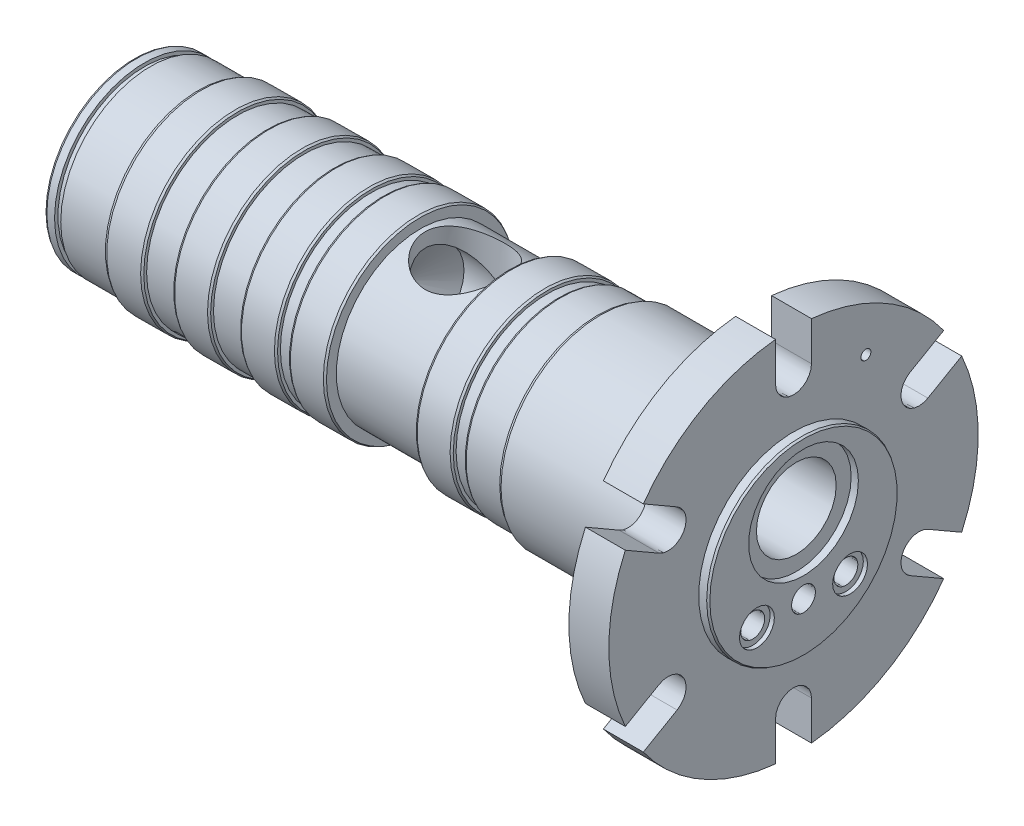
SolidWorks part; units mm, degrees
ref_plane "Face" through (0, 0, 0) normal (0, 0, 1) x (1, 0, 0)
ref_plane "Cote" through (0, 0, 0) normal (0, 1, 0) x (1, 0, 0)
ref_plane "Dessus" through (0, 0, 0) normal (1, 0, 0) x (0, 0, -1)
sketch "Esquisse1" plane through (0, 0, 0) normal (0, 0, 1) x (1, 0, 0)
  line L0 (0, 0) -> (-383.6116, 0) construction
  line L1 (-377.5177, 0) -> (-377.5177, 44.3726)
  line L2 (-376.5177, 44.95) -> (-372.6677, 44.95)
  line L3 (-372.6677, 44.95) -> (-372.6677, 43.25)
  line L4 (-372.6677, 43.25) -> (-369.5177, 43.25)
  line L5 (-369.5177, 43.25) -> (-369.5177, 45)
  line L6 (-369.5177, 45) -> (-345.5177, 45)
  line L7 (-345.5177, 45) -> (-345.5177, 46.634)
  line L8 (-344.0177, 47.5) -> (-327.0177, 47.5)
  line L9 (-145.5177, 47.5) -> (-145.5177, 49.134)
  line L10 (-144.0177, 50) -> (-67.5177, 50)
  line L11 (-67.5177, 50) -> (-67.5177, 92.5)
  line L12 (-67.5177, 92.5) -> (-47.5177, 92.5)
  line L13 (-47.5177, 92.5) -> (-47.5177, 47.5)
  line L14 (-47.5177, 47.5) -> (-43.5177, 47.5)
  line L15 (-42.5177, 46.9226) -> (-42.5177, 0)
  line L16 (-376.5177, 44.95) -> (-377.5177, 44.3726)
  line L17 (-345.5177, 46.634) -> (-344.0177, 47.5)
  line L18 (-326.0177, 46.9226) -> (-326.0177, 45.5)
  line L19 (-326.0177, 45.5) -> (-311.0177, 45.5)
  line L20 (-311.0177, 45.5) -> (-311.0177, 46.9226)
  line L21 (-292.5177, 46.9226) -> (-292.5177, 45.5)
  line L22 (-292.5177, 45.5) -> (-277.5177, 45.5)
  line L23 (-277.5177, 45.5) -> (-277.5177, 46.9226)
  line L24 (-259.0177, 46.9226) -> (-259.0177, 45.5)
  line L25 (-259.0177, 45.5) -> (-253.0177, 45.5)
  line L26 (-253.0177, 45.5) -> (-253.0177, 46.9226)
  line L27 (-234.5177, 46.9226) -> (-234.5177, 42)
  line L28 (-234.5177, 42) -> (-189.5177, 42)
  line L29 (-189.5177, 42) -> (-189.5177, 46.9226)
  line L30 (-171.0177, 46.9226) -> (-171.0177, 45.5)
  line L31 (-171.0177, 45.5) -> (-165.0177, 45.5)
  line L32 (-165.0177, 45.5) -> (-165.0177, 46.9226)
  line L33 (-164.0177, 47.5) -> (-145.5177, 47.5)
  line L34 (-188.5177, 47.5) -> (-172.0177, 47.5)
  line L35 (-252.0177, 47.5) -> (-235.5177, 47.5)
  line L36 (-276.5177, 47.5) -> (-260.0177, 47.5)
  line L37 (-310.0177, 47.5) -> (-293.5177, 47.5)
  line L38 (-145.5177, 49.134) -> (-144.0177, 50)
  line L39 (-43.5177, 47.5) -> (-42.5177, 46.9226)
  line L40 (-327.0177, 47.5) -> (-326.0177, 46.9226)
  line L41 (-311.0177, 46.9226) -> (-310.0177, 47.5)
  line L42 (-292.5177, 46.9226) -> (-293.5177, 47.5)
  line L43 (-277.5177, 46.9226) -> (-276.5177, 47.5)
  line L44 (-260.0177, 47.5) -> (-259.0177, 46.9226)
  line L45 (-253.0177, 46.9226) -> (-252.0177, 47.5)
  line L46 (-235.5177, 47.5) -> (-234.5177, 46.9226)
  line L47 (-189.5177, 46.9226) -> (-188.5177, 47.5)
  line L48 (-172.0177, 47.5) -> (-171.0177, 46.9226)
  line L49 (-165.0177, 46.9226) -> (-164.0177, 47.5)
  line L50 (-377.5177, 0) -> (-42.5177, 0)
  dimension "D1" = 30
  dimension "D2" = 1
  dimension "D3" = 30
  dimension "D4" = 1.5
  dimension "D5" = 30
  dimension "D6" = 1.5
  dimension "D7" = 30
  dimension "D8" = 1
  dimension "D9" = 86.5
  dimension "D10" = 89.9
  dimension "D11" = 90
  dimension "D12" = 30
  dimension "D13" = 1
  dimension "D14" = 30
  dimension "D15" = 1
  dimension "D16" = 30
  dimension "D17" = 1
  dimension "D18" = 30
  dimension "D19" = 1
  dimension "D20" = 30
  dimension "D21" = 1
  dimension "D22" = 30
  dimension "D23" = 1
  dimension "D24" = 30
  dimension "D25" = 1
  dimension "D26" = 30
  dimension "D27" = 1
  dimension "D28" = 30
  dimension "D29" = 1
  dimension "D30" = 30
  dimension "D31" = 1
  dimension "D32" = 91
  dimension "D33" = 91
  dimension "D34" = 91
  dimension "D35" = 91
  dimension "D36" = 84
  dimension "D37" = 95
  dimension "D38" = 3.15
  dimension "D39" = 8
  dimension "D40" = 32
  dimension "D41" = 15
  dimension "D42" = 15
  dimension "D43" = 6
  dimension "D44" = 45
  dimension "D45" = 6
  dimension "D46" = 66.5
  dimension "D47" = 100
  dimension "D48" = 124.5
  dimension "D49" = 188
  dimension "D50" = 212.5
  dimension "D51" = 232
  dimension "D52" = 310
  dimension "D53" = 100
  dimension "D54" = 95
  dimension "D55" = 185
  dimension "D56" = 5
  dimension "D57" = 335
revolve "profil" add sketch "Esquisse1" angle 360 about L0
sketch "axes" plane through (-42.5177, 0, 0) normal (1, 0, 0) x (0, 0, -1)
  line L0 (0, 107.2214) -> (0, -103.8265) construction
  line L1 (-112.0308, 0) -> (107.5043, 0) construction
  line L2 (0, 0) -> (71.3981, -71.3981) construction
  line L3 (0, 0) -> (-75.3493, -75.3493) construction
  line L4 (0, 0) -> (53.0706, 91.9209) construction
  line L5 (89.52, 51.6844) -> (-89.52, -51.6844) construction
  line L6 (-89.4233, 51.6286) -> (89.4233, -51.6286) construction
  circle A0 centre (0, 0) radius 15 construction
  circle A1 centre (0, 0) radius 22.5 construction
  circle A2 centre (0, 0) radius 33 construction
  circle A3 centre (0, 0) radius 72.5 construction
  circle A4 centre (0, 0) radius 37 construction
  dimension "D3" = 30
  dimension "D4" = 45
  dimension "D5" = 66
  dimension "D6" = 145
  dimension "D10" = 74
  dimension "D1" = 45
  dimension "D2" = 45
  dimension "D7" = 30
  dimension "D8" = 30
  dimension "D9" = 30
sketch "Esquisse3" plane through (-377.5177, 0, 0) normal (-1, 0, 0) x (0, 0, 1)
  line L0 (0, 107.2214) -> (0, -103.8265) construction
  line L1 (112.0308, 0) -> (-107.5043, 0) construction
  circle A0 centre (0, 0) radius 30
  dimension "D1" = 60
extrude "Ø 60 prof 40" cut sketch "Esquisse3" against normal blind 40
hole_wizard "Ø 5 prof 5" positions "Esquisse5" profile "Esquisse4" hole size "Ø8.0" standard "ISO"
sketch "Esquisse5" plane through (-47.5177, 0, 0) normal (1, 0, 0) x (0, 0, -1)
  line L0 (0, 0) -> (53.0706, 91.9209) construction
  circle A0 centre (0, 0) radius 72.5 construction
  point P0 (36.25, 62.7868)
sketch "Esquisse4" plane through (-47.5177, 62.7868, -36.25) normal (0, 1, 0) x (0, 0, -1)
  line L0 (0, 0) -> (0, 6.4434)
  line L1 (0, 6.4434) -> (2.5, 5)
  line L2 (2.5, 5) -> (2.5, 0)
  line L5 (2.5, 0) -> (0, 0)
  line L10 (0, 6.4434) -> (-2.5, 5) construction
  line L11 (0, -6.35) -> (0, 107.95) construction
  dimension "Diamètre du perçage" = 5
  dimension "Profondeur du perçage" = 5
  dimension "Angle de pointe" = 120
sketch "Esquisse6" plane through (-47.5177, 0, 0) normal (1, 0, 0) x (0, 0, -1)
  line L0 (0, 107.2214) -> (0, -103.8265) construction
  line L1 (-9, 72.5) -> (-9, 98.3966)
  line L2 (-9, 98.3966) -> (9, 98.3966)
  line L3 (9, 98.3966) -> (9, 72.5)
  arc A0 (-9, 72.5) -> (9, 72.5) centre (0, 72.5) ccw
  circle A1 centre (0, 0) radius 72.5 construction
  dimension "D1" = 18
extrude "1er lumière" cut sketch "Esquisse6" against normal through all
pattern_circular "6 lumières" count 6 over 360 about axis through (0, 0, 0) along (-1, 0, 0) of "1er lumière"
hole_wizard "Ø 12 traversant" positions "Esquisse8" profile "Esquisse7" hole size "Ø8.0" standard "ISO"
sketch "Esquisse8" plane through (-42.5177, 0, 0) normal (1, 0, 0) x (0, 0, -1)
  line L0 (0, 107.2214) -> (0, -103.8265) construction
  circle A0 centre (0, 0) radius 22.5 construction
  point P0 (0, -22.5)
sketch "Esquisse7" plane through (-42.5177, -22.5, 0) normal (0, 1, 0) x (0, 0, -1)
  line L0 (0, 0) -> (0, 335)
  line L1 (0, 335) -> (6, 335)
  line L2 (6, 335) -> (6, 0)
  line L5 (6, 0) -> (0, 0)
  line L11 (0, -6.35) -> (0, 107.95) construction
  dimension "Diamètre du perçage jusqu'au prochain" = 12
  dimension "Profondeur du perçage jusqu'au prochain" = 335
hole_wizard "cir 1 hori" positions "Esquisse10" profile "Esquisse9" counterbore size "M1.6" standard "ISO"
sketch "Esquisse10" plane through (-42.5177, 0, 0) normal (1, 0, 0) x (0, 0, -1)
  line L0 (0, 107.2214) -> (0, -103.8265) construction
  circle A0 centre (0, 0) radius 15 construction
  point P0 (0, 15)
sketch "Esquisse9" plane through (-42.5177, 15, 0) normal (0, 1, 0) x (0, 0, -1)
  line L0 (0, 0) -> (0, 201.547)
  line L1 (0, 201.547) -> (20, 190)
  line L2 (20, 190) -> (20, 3.6)
  line L3 (20, 3.6) -> (27.5, 3.6)
  line L4 (27.5, 3.6) -> (27.5, 0)
  line L5 (27.5, 0) -> (0, 0)
  line L10 (0, 201.547) -> (-20, 190) construction
  line L11 (0, -6.35) -> (0, 107.95) construction
  dimension "Diamètre du perçage" = 40
  dimension "Profondeur du perçage" = 190
  dimension "Diamètre du chambrage" = 55
  dimension "Profondeur du chambrage" = 3.6
  dimension "Angle de pointe" = 120
hole_wizard "cir 2 hori" positions "Esquisse12" profile "Esquisse11" counterbore size "M1.6" standard "ISO"
sketch "Esquisse12" plane through (-42.5177, 0, 0) normal (1, 0, 0) x (0, 0, -1)
  line L0 (0, 0) -> (71.3981, -71.3981) construction
  circle A0 centre (0, 0) radius 33 construction
  point P0 (23.3345, -23.3345)
sketch "Esquisse11" plane through (-42.5177, -23.3345, -23.3345) normal (0, 1, 0) x (0, 0, -1)
  line L0 (0, 0) -> (0, 252.4641)
  line L1 (0, 252.4641) -> (6, 249)
  line L2 (6, 249) -> (6, 2.1)
  line L3 (6, 2.1) -> (8.75, 2.1)
  line L4 (8.75, 2.1) -> (8.75, 0)
  line L5 (8.75, 0) -> (0, 0)
  line L10 (0, 252.4641) -> (-6, 249) construction
  line L11 (0, -6.35) -> (0, 107.95) construction
  dimension "Diamètre du perçage" = 12
  dimension "Profondeur du perçage" = 249
  dimension "Diamètre du chambrage" = 17.5
  dimension "Profondeur du chambrage" = 2.1
  dimension "Angle de pointe" = 120
hole_wizard "cir 3 hori" positions "Esquisse14" profile "Esquisse13" counterbore size "M1.6" standard "ISO"
sketch "Esquisse14" plane through (-42.5177, 0, 0) normal (1, 0, 0) x (0, 0, -1)
  line L0 (0, 0) -> (-75.3493, -75.3493) construction
  circle A0 centre (0, 0) radius 33 construction
  point P0 (-23.3345, -23.3345)
sketch "Esquisse13" plane through (-42.5177, -23.3345, 23.3345) normal (0, 1, 0) x (0, 0, -1)
  line L0 (0, 0) -> (0, 285.4641)
  line L1 (0, 285.4641) -> (6, 282)
  line L2 (6, 282) -> (6, 2.1)
  line L3 (6, 2.1) -> (8.75, 2.1)
  line L4 (8.75, 2.1) -> (8.75, 0)
  line L5 (8.75, 0) -> (0, 0)
  line L10 (0, 285.4641) -> (-6, 282) construction
  line L11 (0, -6.35) -> (0, 107.95) construction
  dimension "Diamètre du perçage" = 12
  dimension "Profondeur du perçage" = 282
  dimension "Diamètre du chambrage" = 17.5
  dimension "Profondeur du chambrage" = 2.1
  dimension "Angle de pointe" = 120
ref_plane "Plan1 cir 1 verti" through (-212.0177, 0, 0) normal (1, 0, 0) x (0, 0, -1)
sketch "Esquisse15" plane through (-212.0177, 0, 0) normal (1, 0, 0) x (0, 0, -1)
  line L0 (0, 15) -> (-20, 15)
  line L1 (-20, 15) -> (-20, 60.2171)
  line L2 (-20, 60.2171) -> (0, 60.2171)
  line L3 (0, 107.2214) -> (0, -103.8265) construction
  line L4 (0, 67.1249) -> (0, 9.7516) construction
  line L5 (0, 15) -> (0, 60.2171)
  dimension "D1" = 40
revolve "cir 1 verti" cut sketch "Esquisse15" angle 360 about L4
ref_plane "Plan2 cir 2 verti" through (-285.0177, 0, 0) normal (1, 0, 0) x (0, 0, -1)
sketch "Esquisse16" plane through (-285.0177, 0, 0) normal (1, 0, 0) x (0, 0, -1)
  line L0 (23.3345, -23.3345) -> (27.5772, -19.0919)
  line L1 (27.5772, -19.0919) -> (45.7779, -37.2926)
  line L2 (45.7779, -37.2926) -> (41.5353, -41.5353)
  line L3 (0, 0) -> (71.3981, -71.3981) construction
  line L4 (20.3085, -20.3085) -> (46.2111, -46.2111) construction
  line L5 (23.3345, -23.3345) -> (41.5353, -41.5353)
  dimension "D1" = 12
revolve "cir 2 verti" cut sketch "Esquisse16" angle 360 about L4
ref_plane "Plan3 cir 3 verti" through (-318.5177, 0, 0) normal (1, 0, 0) x (0, 0, -1)
sketch "Esquisse17" plane through (-318.5177, 0, 0) normal (1, 0, 0) x (0, 0, -1)
  line L0 (-23.3345, -23.3345) -> (-19.0919, -27.5772)
  line L1 (-19.0919, -27.5772) -> (-42.5373, -51.0226)
  line L2 (-42.5373, -51.0226) -> (-46.7799, -46.7799)
  line L3 (0, 0) -> (-75.3493, -75.3493) construction
  line L4 (-20.2375, -20.2375) -> (-49.8347, -49.8347) construction
  line L5 (-23.3345, -23.3345) -> (-46.7799, -46.7799)
  dimension "D1" = 12
revolve "cir 3 verti" cut sketch "Esquisse17" angle 360 about L4
hole_wizard "1er M8" positions "Esquisse19" profile "Esquisse18" hole size "Ø8.0" standard "ISO"
sketch "Esquisse19" plane through (-377.5177, 0, 0) normal (-1, 0, 0) x (0, 0, 1)
  line L0 (0, 107.2214) -> (0, -103.8265) construction
  circle A0 centre (0, 0) radius 37 construction
  point P0 (0, 37)
sketch "Esquisse18" plane through (-377.5177, 37, 0) normal (0, 1, 0) x (0, 0, 1)
  line L0 (0, 0) -> (0, 19.8666)
  line L1 (0, 19.8666) -> (3.233, 18)
  line L2 (3.233, 18) -> (3.233, 0)
  line L5 (3.233, 0) -> (0, 0)
  line L10 (0, 19.8666) -> (-3.233, 18) construction
  line L11 (0, -6.35) -> (0, 107.95) construction
  dimension "Diamètre du perçage" = 6.466
  dimension "Profondeur du perçage" = 18
  dimension "Angle de pointe" = 120
pattern_circular "3 x M8" count 3 over 360 about axis through (0, 0, 0) along (-1, 0, 0) of "1er M8"
